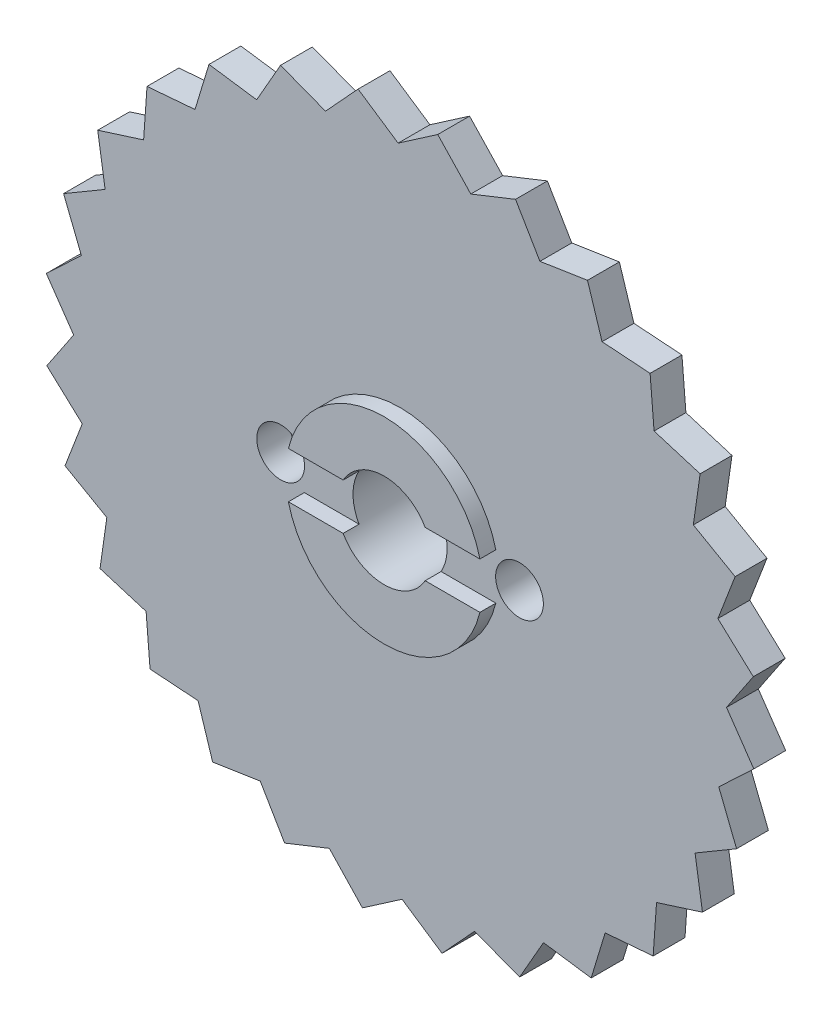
SolidWorks part; units mm, degrees
ref_plane "Plan de face" through (0, 0, 0) normal (0, 0, 1) x (1, 0, 0)
ref_plane "Plan de dessus" through (0, 0, 0) normal (0, 1, 0) x (1, 0, 0)
ref_plane "Plan de droite" through (0, 0, 0) normal (1, 0, 0) x (0, 0, -1)
sketch "Esquisse1" plane through (0, 0, 0) normal (0, 0, 1) x (1, 0, 0)
  circle A0 centre (0, 0) radius 22.34
  dimension "D1" = 44.68
extrude "Extrusion1" add sketch "Esquisse1" along normal blind 9
sketch "Esquisse2" plane through (0, 0, 9) normal (0, 0, 1) x (1, 0, 0)
  circle A0 centre (0, 0) radius 6.185
  circle A1 centre (0, 0) radius 22.34
  dimension "D1" = 12.37
  dimension "D2" = 44.68
extrude "Enlèv. mat.-Extru.1" cut sketch "Esquisse2" against normal blind 1
sketch "Esquisse3" plane through (0, 0, 9) normal (0, 0, 1) x (1, 0, 0)
  circle A0 centre (0, 0) radius 2.955
  dimension "D1" = 5.91
extrude "Enlèv. mat.-Extru.2" cut sketch "Esquisse3" against normal through all
sketch "Esquisse4" plane through (0, 0, 0) normal (0, 0, -1) x (-1, 0, 0)
  circle A0 centre (0, 0) radius 8.5
  circle A1 centre (0, 0) radius 22.34
  dimension "D1" = 17
  dimension "D2" = 44.68
extrude "Enlèv. mat.-Extru.3" cut sketch "Esquisse4" against normal blind 6
sketch "Esquisse5" plane through (0, 0, 0) normal (0, 0, -1) x (-1, 0, 0)
  circle A0 centre (0, 0) radius 6.975
  circle A2 centre (0, 0) radius 8.5
  dimension "D1" = 17
  dimension "D2" = 13.95
extrude "Enlèv. mat.-Extru.4" cut sketch "Esquisse5" against normal blind 1
sketch "Esquisse6" plane through (0, 0, 1) normal (0, 0, -1) x (-1, 0, 0)
  circle A0 centre (0, 0) radius 5.97
  circle A1 centre (0, 0) radius 8.5
  dimension "D1" = 11.94
  dimension "D2" = 17
extrude "Enlèv. mat.-Extru.5" cut sketch "Esquisse6" against normal blind 3.22
sketch "Esquisse7" plane through (0, 0, 4.22) normal (0, 0, -1) x (-1, 0, 0)
  circle A0 centre (0, 0) radius 6.96
  circle A1 centre (0, 0) radius 8.5
  dimension "D1" = 13.92
  dimension "D2" = 17
extrude "Enlèv. mat.-Extru.6" cut sketch "Esquisse7" against normal blind 1.78
sketch "Esquisse9" plane through (0, 0, 8) normal (0, 0, 1) x (1, 0, 0)
  line L0 (-22.184, -2.6357) -> (0, 0) construction
  line L1 (0, 0) -> (-22.2143, 2.3668) construction
  line L2 (0, 0) -> (-22.3396, -0.1353)
  line L3 (-19.3801, -2.3026) -> (-19.3933, -0.1175) construction
  line L4 (-19.3933, -0.1175) -> (-19.4065, 2.0676) construction
  line L5 (-22.184, -2.6357) -> (-20.4996, -0.1242)
  line L6 (-20.4996, -0.1242) -> (-22.2143, 2.3668)
  line L7 (-22.184, -2.6357) -> (-19.958, -4.6827)
  line L8 (-19.958, -4.6827) -> (-21.0413, -7.506)
  line L9 (0, 0) -> (-21.0413, -7.506) construction
  line L10 (-15.9498, -12.8784) -> (-15.7008, -15.8922)
  line L11 (-18.8435, -12) -> (-15.9498, -12.8784)
  line L12 (-18.8435, -12) -> (-18.4156, -9.0063)
  line L13 (-18.4156, -9.0063) -> (-21.0413, -7.506)
  line L14 (0, 0) -> (-15.7008, -15.8922) construction
  line L15 (-12.6842, -16.1047) -> (-15.7008, -15.8922)
  line L16 (-11.7708, -18.9875) -> (-12.6842, -16.1047)
  line L17 (-11.7708, -18.9875) -> (-8.7826, -18.5234)
  line L18 (-8.7826, -18.5234) -> (-7.2506, -21.1307)
  line L19 (-4.4405, -20.0133) -> (-7.2506, -21.1307)
  line L20 (-2.3668, -22.2143) -> (-4.4405, -20.0133)
  line L21 (-2.3668, -22.2143) -> (0.1242, -20.4996)
  line L22 (0.1242, -20.4996) -> (2.6357, -22.184)
  line L23 (0, 0) -> (2.6357, -22.184) construction
  line L24 (4.6827, -19.958) -> (2.6357, -22.184)
  line L25 (7.506, -21.0413) -> (4.6827, -19.958)
  line L26 (7.506, -21.0413) -> (9.0063, -18.4156)
  line L27 (9.0063, -18.4156) -> (12, -18.8435)
  line L28 (12.8784, -15.9498) -> (12, -18.8435)
  line L29 (15.8922, -15.7008) -> (12.8784, -15.9498)
  line L30 (15.8922, -15.7008) -> (16.1047, -12.6842)
  line L31 (16.1047, -12.6842) -> (18.9875, -11.7708)
  line L32 (18.5234, -8.7826) -> (18.9875, -11.7708)
  line L33 (21.1307, -7.2506) -> (18.5234, -8.7826)
  line L34 (21.1307, -7.2506) -> (20.0133, -4.4405)
  line L35 (20.0133, -4.4405) -> (22.2143, -2.3668)
  line L36 (20.4996, 0.1242) -> (22.2143, -2.3668)
  line L37 (22.184, 2.6357) -> (20.4996, 0.1242)
  line L38 (22.184, 2.6357) -> (19.958, 4.6827)
  line L39 (19.958, 4.6827) -> (21.0413, 7.506)
  line L40 (-7.506, 21.0413) -> (-9.0063, 18.4156)
  line L41 (-9.0063, 18.4156) -> (-12, 18.8435)
  line L42 (-12.8784, 15.9498) -> (-12, 18.8435)
  line L43 (-15.8922, 15.7008) -> (-12.8784, 15.9498)
  line L44 (-15.8922, 15.7008) -> (-16.1047, 12.6842)
  line L45 (-16.1047, 12.6842) -> (-18.9875, 11.7708)
  line L46 (-18.5234, 8.7826) -> (-18.9875, 11.7708)
  line L47 (-21.1307, 7.2506) -> (-18.5234, 8.7826)
  line L48 (-21.1307, 7.2506) -> (-20.0133, 4.4405)
  line L49 (-20.0133, 4.4405) -> (-22.2143, 2.3668)
  line L50 (21.0413, 7.506) -> (0, 0) construction
  line L51 (-7.506, 21.0413) -> (-4.6827, 19.958)
  line L52 (-4.6827, 19.958) -> (-2.6357, 22.184)
  line L53 (-0.1242, 20.4996) -> (-2.6357, 22.184)
  line L54 (2.3668, 22.2143) -> (-0.1242, 20.4996)
  line L55 (2.3668, 22.2143) -> (4.4405, 20.0133)
  line L56 (4.4405, 20.0133) -> (7.2506, 21.1307)
  line L57 (8.7826, 18.5234) -> (7.2506, 21.1307)
  line L58 (11.7708, 18.9875) -> (8.7826, 18.5234)
  line L59 (11.7708, 18.9875) -> (12.6842, 16.1047)
  line L60 (12.6842, 16.1047) -> (15.7008, 15.8922)
  line L61 (15.9498, 12.8784) -> (15.7008, 15.8922)
  line L62 (18.8435, 12) -> (15.9498, 12.8784)
  line L63 (18.8435, 12) -> (18.4156, 9.0063)
  line L64 (18.4156, 9.0063) -> (21.0413, 7.506)
  circle A0 centre (0, 0) radius 22.34
  circle A1 centre (0, 0) radius 20.5
  arc A2 (-22.2143, 2.3668) -> (-22.184, -2.6357) centre (-20.4996, -0.1242) ccw
  arc A3 (-21.0413, -7.506) -> (-22.184, -2.6357) centre (-19.958, -4.6827) cw
  arc A4 (-15.7008, -15.8922) -> (-18.8435, -12) centre (-15.9498, -12.8784) cw
  arc A5 (-21.0413, -7.506) -> (-18.8435, -12) centre (-18.4156, -9.0063) ccw
  arc A6 (-15.7008, -15.8922) -> (-11.7708, -18.9875) centre (-12.6842, -16.1047) ccw
  arc A7 (-7.2506, -21.1307) -> (-11.7708, -18.9875) centre (-8.7826, -18.5234) cw
  arc A8 (-7.2506, -21.1307) -> (-2.3668, -22.2143) centre (-4.4405, -20.0133) ccw
  arc A9 (2.6357, -22.184) -> (-2.3668, -22.2143) centre (0.1242, -20.4996) cw
  arc A10 (2.6357, -22.184) -> (7.506, -21.0413) centre (4.6827, -19.958) ccw
  arc A11 (12, -18.8435) -> (7.506, -21.0413) centre (9.0063, -18.4156) cw
  arc A12 (12, -18.8435) -> (15.8922, -15.7008) centre (12.8784, -15.9498) ccw
  arc A13 (18.9875, -11.7708) -> (15.8922, -15.7008) centre (16.1047, -12.6842) cw
  arc A14 (18.9875, -11.7708) -> (21.1307, -7.2506) centre (18.5234, -8.7826) ccw
  arc A15 (22.2143, -2.3668) -> (21.1307, -7.2506) centre (20.0133, -4.4405) cw
  arc A16 (22.2143, -2.3668) -> (22.184, 2.6357) centre (20.4996, 0.1242) ccw
  arc A17 (21.0413, 7.506) -> (22.184, 2.6357) centre (19.958, 4.6827) cw
  arc A18 (-12, 18.8435) -> (-7.506, 21.0413) centre (-9.0063, 18.4156) cw
  arc A19 (-12, 18.8435) -> (-15.8922, 15.7008) centre (-12.8784, 15.9498) ccw
  arc A20 (-18.9875, 11.7708) -> (-15.8922, 15.7008) centre (-16.1047, 12.6842) cw
  arc A21 (-18.9875, 11.7708) -> (-21.1307, 7.2506) centre (-18.5234, 8.7826) ccw
  arc A22 (-22.2143, 2.3668) -> (-21.1307, 7.2506) centre (-20.0133, 4.4405) cw
  arc A23 (-2.6357, 22.184) -> (-7.506, 21.0413) centre (-4.6827, 19.958) ccw
  arc A24 (-2.6357, 22.184) -> (2.3668, 22.2143) centre (-0.1242, 20.4996) cw
  arc A25 (7.2506, 21.1307) -> (2.3668, 22.2143) centre (4.4405, 20.0133) ccw
  arc A26 (7.2506, 21.1307) -> (11.7708, 18.9875) centre (8.7826, 18.5234) cw
  arc A27 (15.7008, 15.8922) -> (11.7708, 18.9875) centre (12.6842, 16.1047) ccw
  arc A28 (15.7008, 15.8922) -> (18.8435, 12) centre (15.9498, 12.8784) cw
  arc A29 (21.0413, 7.506) -> (18.8435, 12) centre (18.4156, 9.0063) ccw
  point P9 (-20.4996, -0.1242)
  dimension "D1" = 44.68
  dimension "D2" = 41
  dimension "D3" = 12.857
  dimension "D4" = 1.84
extrude "Enlèv. mat.-Extru.7" cut sketch "Esquisse9" against normal through all
sketch "Esquisse13" plane through (0, 0, 9) normal (0, 0, 1) x (1, 0, 0)
  line L0 (-6.185, 0) -> (6.185, 0) construction
  line L1 (6.185, 0) -> (6.185, 1.45)
  line L2 (6.185, 0) -> (6.185, -1.45)
  line L3 (-6.185, 0) -> (-6.185, 1.45)
  line L4 (-6.185, -1.45) -> (6.185, -1.45)
  line L5 (-6.185, 1.45) -> (6.185, 1.45)
  line L7 (-6.185, 0) -> (-6.185, -1.45)
  circle A0 centre (0, 0) radius 6.185 construction
  dimension "D1" = 1.45
  dimension "D2" = 1.45
extrude "Enlèv. mat.-Extru.14" cut sketch "Esquisse13" against normal blind 1
sketch "Esquisse14" plane through (0, 0, 0) normal (0, 0, -1) x (-1, 0, 0)
  line L0 (-6.975, 0) -> (6.975, 0) construction
  line L1 (6.975, 0) -> (6.975, 1.45)
  line L2 (6.975, 0) -> (6.975, -1.45)
  line L3 (6.975, 1.45) -> (-6.975, 1.45)
  line L4 (-6.975, 1.45) -> (-6.975, -1.45)
  line L5 (-6.975, -1.45) -> (6.975, -1.45)
  circle A0 centre (0, 0) radius 6.975 construction
  dimension "D1" = 1.45
  dimension "D2" = 1.45
extrude "Enlèv. mat.-Extru.15" cut sketch "Esquisse14" against normal blind 0.5
sketch "Esquisse15" plane through (0, 0, 0) normal (1, 0, 0) x (0, 0, -1)
  line L0 (-2.61, 5.97) -> (-2.61, -5.97) construction
  line L1 (-4.22, 5.97) -> (-1, 5.97)
  line L2 (-4.22, 5.97) -> (-4.22, -5.97)
  line L3 (-4.22, -5.97) -> (-1, -5.97)
  line L4 (-1, 5.97) -> (-1, -5.97)
  line L5 (-4.22, 0) -> (-1, 0) construction
  line L6 (-2.61, 1.5) -> (-2.61, -1.5)
  line L7 (-4.11, 0) -> (-1.11, 0)
  circle A0 centre (-2.61, 0) radius 1.5
  dimension "D1" = 3
extrude "Enlèv. mat.-Extru.16" cut sketch "Esquisse15" against normal through all and the other way through all
sketch "Esquisse16" plane through (0, 0, 8) normal (0, 0, 1) x (1, 0, 0)
  line L0 (-18.7041, 0) -> (17.2521, 0) construction
  line L1 (0, 16.1419) -> (0, -18.1916) construction
  circle A0 centre (-7.5, 0) radius 1.5
  circle A1 centre (7.5, 0) radius 1.5
  dimension "D1" = 3
  dimension "D2" = 7.5
extrude "Enlèv. mat.-Extru.17" cut sketch "Esquisse16" against normal blind 10
